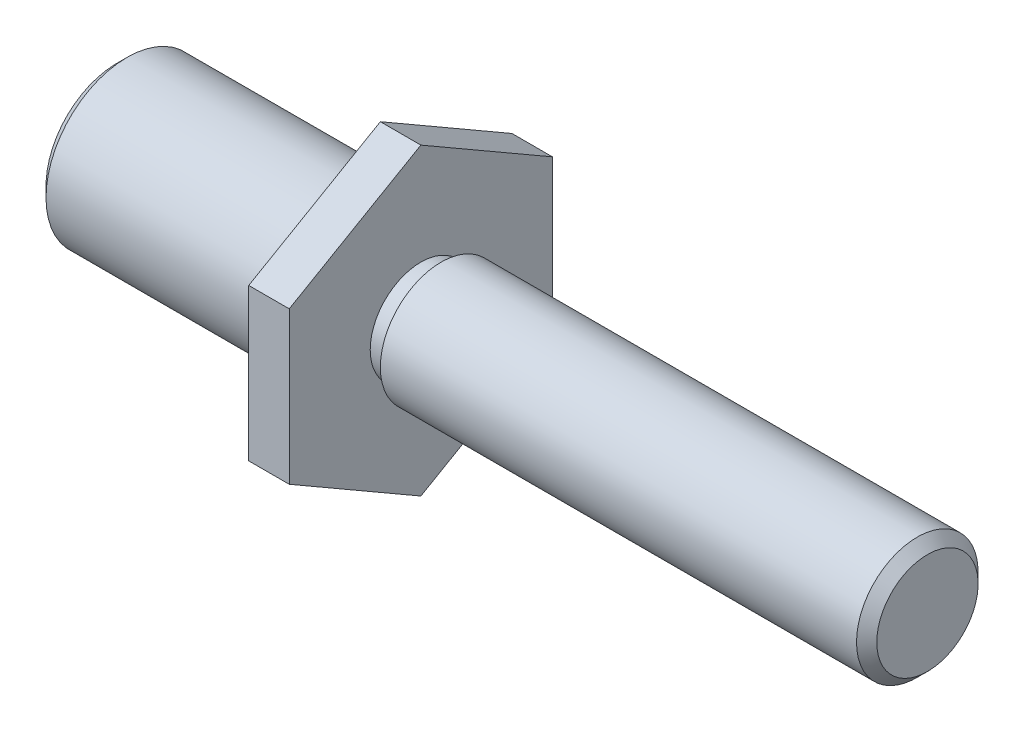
SolidWorks part; units mm, degrees
ref_plane "Plan1" through (0, 0, 0) normal (0, 0, 1) x (1, 0, 0)
ref_plane "Plan2" through (0, 0, 0) normal (0, 1, 0) x (1, 0, 0)
ref_plane "Plan3" through (0, 0, 0) normal (1, 0, 0) x (0, 0, -1)
sketch "Esquisse1" plane through (0, 0, 0) normal (0, 0, 1) x (1, 0, 0)
  line L0 (0, 0) -> (0, 4)
  line L1 (0, 4) -> (12, 4)
  line L2 (12, 4) -> (12, 3.5)
  line L3 (12, 3.5) -> (13, 3.5)
  line L4 (13, 3.5) -> (13, 7.5)
  line L5 (13, 7.5) -> (15, 7.5)
  line L6 (15, 7.5) -> (15, 2.5)
  line L7 (15, 2.5) -> (16, 2.5)
  line L8 (16, 2.5) -> (16, 3)
  line L9 (16, 3) -> (40, 3)
  line L10 (40, 3) -> (40, 0)
  line L11 (40, 0) -> (0, 0)
  line L12 (0, 0) -> (71, 0) construction
  dimension "D1" = 3
  dimension "D2" = 4
  dimension "D3" = 1
  dimension "D4" = 1
  dimension "D5" = 12
  dimension "D6" = 2
  dimension "D7" = 24
  dimension "D8" = 7.5
  dimension "D9" = 3.5
  dimension "D10" = 2.5
revolve "Base-Révolution" add sketch "Esquisse1" angle 360 about L12
chamfer "Chanfrein1" distance 0.5 angle 45 2 edges at (0, 0, 4) (40, 0, 3)
sketch "Esquisse3" plane through (0, 0, 0) normal (1, 0, 0) x (0, 0, -1)
  line L0 (-6.4952, 3.75) -> (-6.4952, -3.75)
  line L1 (-6.4952, -3.75) -> (0, -7.5)
  line L2 (0, -7.5) -> (6.4952, -3.75)
  line L3 (6.4952, -3.75) -> (6.4952, 3.75)
  line L4 (6.4952, 3.75) -> (0, 7.5)
  line L5 (0, 7.5) -> (-6.4952, 3.75)
  line L6 (0, 0) -> (0, 13) construction
  circle A0 centre (0, 0) radius 7.5 construction
  dimension "D1" = 7.5
  dimension "D2" = 7.5
  dimension "D3" = 120
  dimension "D4" = 120
extrude "Enlèv. mat.-Extru.2" cut sketch "Esquisse3" along normal through all flip side to cut
